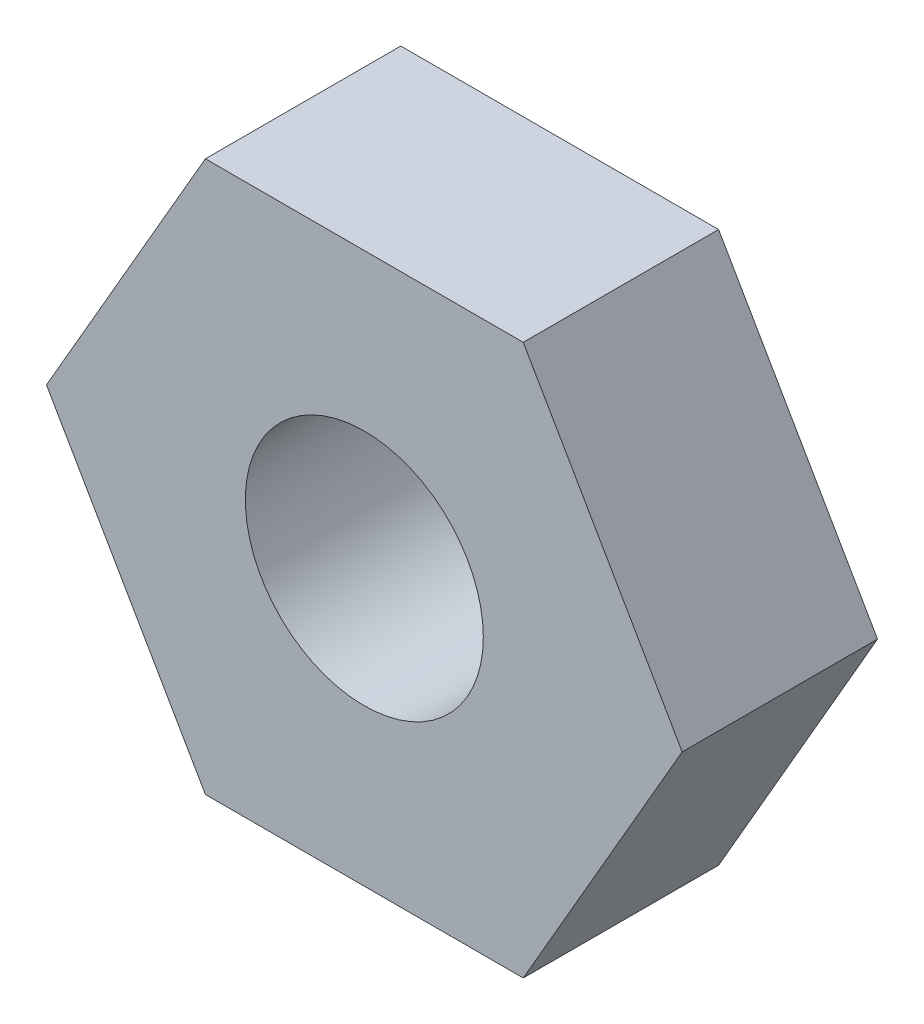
SolidWorks part; units mm, degrees
ref_plane "Front Plane" through (0, 0, 0) normal (0, 0, 1) x (1, 0, 0)
ref_plane "Top Plane" through (0, 0, 0) normal (0, 1, 0) x (1, 0, 0)
ref_plane "Right Plane" through (0, 0, 0) normal (1, 0, 0) x (0, 0, -1)
sketch "Sketch1" plane through (0, 0, 0) normal (0, 0, 1) x (1, 0, 0)
  line L1 (4.5461, 0) -> (2.273, 3.937)
  line L2 (2.273, 3.937) -> (-2.273, 3.937)
  line L3 (-2.273, 3.937) -> (-4.5461, 0)
  line L4 (-4.5461, 0) -> (-2.273, -3.937)
  line L5 (-2.273, -3.937) -> (2.273, -3.937)
  line L6 (2.273, -3.937) -> (4.5461, 0)
  circle A0 centre (0, 0) radius 3.937 construction
  dimension "D1" = 7.874
extrude "Boss-Extrude1" add sketch "Sketch1" along normal blind 2.794
sketch "Sketch2" plane through (0, 0, 2.794) normal (0, 0, 1) x (1, 0, 0)
  circle A0 centre (0, 0) radius 1.7018
  dimension "D1" = 3.4036
extrude "Cut-Extrude1" cut sketch "Sketch2" against normal through all
